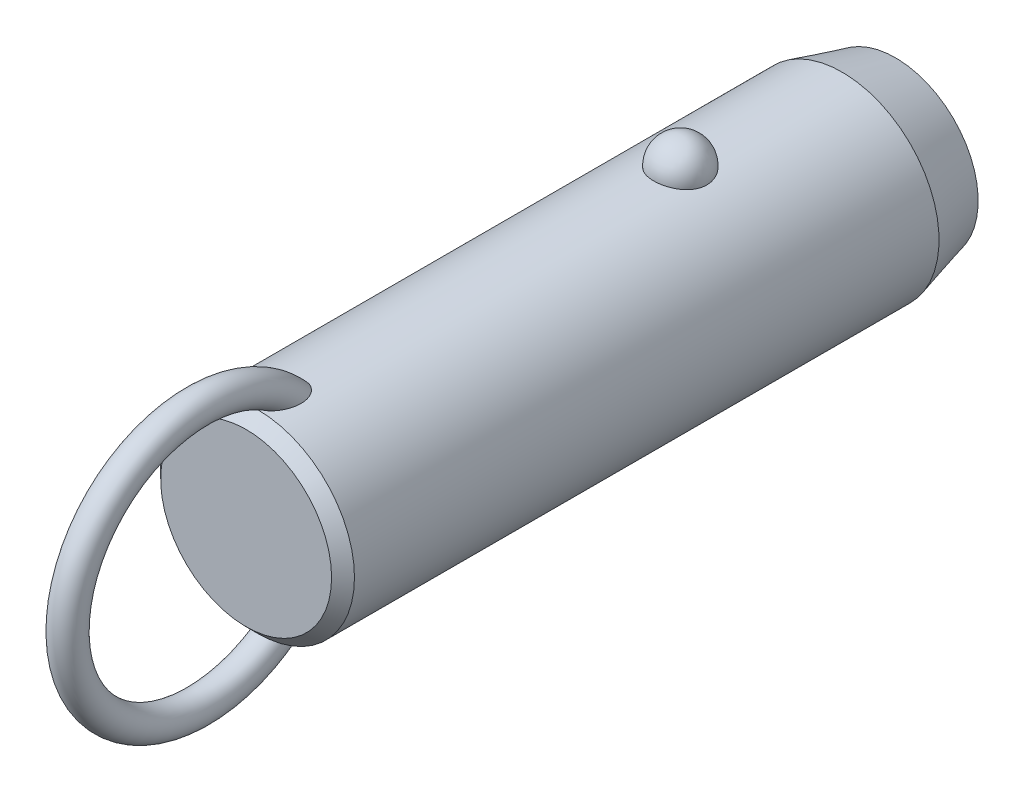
SolidWorks part; units mm, degrees
ref_plane "Front Plane" through (0, 0, 0) normal (0, 0, 1) x (1, 0, 0)
ref_plane "Top Plane" through (0, 0, 0) normal (0, 1, 0) x (1, 0, 0)
ref_plane "Right Plane" through (0, 0, 0) normal (1, 0, 0) x (0, 0, -1)
sketch "Sketch2" plane through (0, 0, 0) normal (0, 0, 1) x (1, 0, 0)
  circle A0 centre (0, 0) radius 12.7
  point P3 (0, 12.7)
  dimension "D1" = 25.4
extrude "Boss-Extrude1" add sketch "Sketch2" along normal blind 40.7
sketch "Sketch3" plane through (0, 0, 0) normal (0, 0, -1) x (-1, 0, 0)
  circle A0 centre (0, 0) radius 12.7
  dimension "D1" = 25.4
extrude "Boss-Extrude2" add sketch "Sketch3" along normal blind 31.7
chamfer "Chamfer1" distance 7 angle 15 1 edges at (-12.7, 0, -31.7)
sketch "Sketch12" plane through (0, 0, 0) normal (1, 0, 0) x (0, 0, -1)
  line L0 (-40.7, 12.7) -> (-40.7, -12.7) construction
  point P0 (-40.7, 0)
sketch "Sketch13" plane through (0, 0, 0) normal (1, 0, 0) x (0, 0, -1)
  circle A0 centre (-59.75, 0) radius 19.05
  point P2 (-40.7, 0)
  dimension "D1" = 38.1
sketch "Sketch14" plane through (0, 0, 0) normal (0, 1, 0) x (1, 0, 0)
  circle A0 centre (0, -42.7) radius 2
  point P2 (0, -40.7)
  dimension "D1" = 4
sweep "Sweep1" add profiles "Sketch14" path "Sketch13"
sketch "Sketch15" plane through (0, 0, 40.7) normal (0, 0, 1) x (1, 0, 0)
  circle A0 centre (0, 0) radius 12.7
  dimension "D1" = 25.4
extrude "Boss-Extrude3" add sketch "Sketch15" along normal blind 12.7
chamfer "Chamfer2" distance 1.5 angle 45 1 edges at (12.7, 0, 53.4)
sketch "Sketch18" plane through (0, 0, 0) normal (1, 0, 0) x (0, 0, -1)
  line L0 (24.7, 12.7) -> (-45.551, 12.7) construction
  line L1 (3.5, 16.2) -> (3.5, 9.2)
  line L2 (-45.551, -12.7) -> (24.7, -12.7) construction
  arc A0 (3.5, 16.2) -> (3.5, 9.2) centre (3.5, 12.7) ccw
  point P4 (0, 12.7)
  dimension "D1" = 28.9
revolve "Revolve1" add sketch "Sketch18" angle 360 about L1
